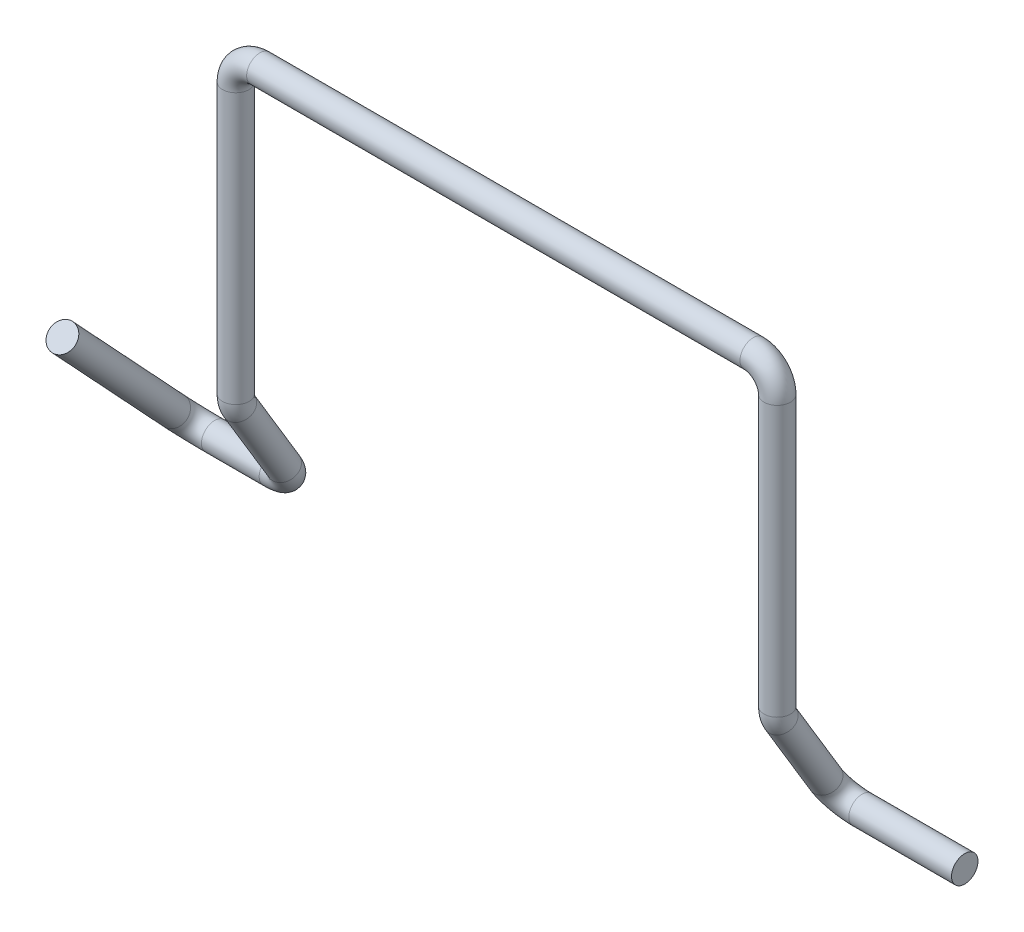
SolidWorks part; units mm, degrees
ref_plane "Front Plane" through (0, 0, 0) normal (0, 0, 1) x (1, 0, 0)
ref_plane "Top Plane" through (0, 0, 0) normal (0, 1, 0) x (1, 0, 0)
ref_plane "Right Plane" through (0, 0, 0) normal (1, 0, 0) x (0, 0, -1)
sketch "Sketch1" plane through (0, 0, 0) normal (1, 0, 0) x (0, 0, -1)
  line L0 (0, 0) -> (0, -15.875)
  line L1 (0, -15.875) -> (3.2004, -21.1963)
  circle A0 centre (0, 0) radius 0.6985 construction
  circle A1 centre (3.2004, -21.1963) radius 0.6985 construction
  dimension "D1" = 1.397
  dimension "D2" = 15.875
  dimension "D3" = 3.2004
  dimension "D4" = 5.3213
ref_plane "Plane1" through (-28.575, 0, 0) normal (1, 0, 0) x (0, 0, -1)
sketch "Sketch2" plane through (-28.575, 0, 0) normal (1, 0, 0) x (0, 0, -1)
  line L0 (0, 0) -> (0, -15.875) construction
  line L1 (0, -15.875) -> (3.2004, -21.1963) construction
  line L2 (0, 0) -> (0, -15.875)
  line L3 (0, -15.875) -> (3.2004, -21.1963)
sketch "Sketch3" plane through (0, 0, 0) normal (0, 1, 0) x (1, 0, 0)
  line L0 (0, 0) -> (-28.575, 0)
ref_plane "Plane2" through (0, -21.1963, 0) normal (0, 1, 0) x (1, 0, 0)
sketch "Sketch4" plane through (0, -21.1963, 0) normal (0, 1, 0) x (1, 0, 0)
  line L0 (0, 3.2004) -> (6.6929, 3.2004)
  line L1 (-28.575, 3.2004) -> (-34.163, 3.2004)
  dimension "D1" = 6.6929
  dimension "D2" = 5.588
ref_plane "Plane3" through (-34.163, 0, 0) normal (1, 0, 0) x (0, 0, -1)
sketch "Sketch5" plane through (-34.163, 0, 0) normal (1, 0, 0) x (0, 0, -1)
  line L0 (3.2004, -21.1963) -> (-3.5641, -13.9422)
  line L1 (3.2004, -21.1963) -> (-2.4652, -21.1963) construction
  dimension "D1" = 9.9187
  dimension "D2" = 47
sketch3d "3DSketch1"
  line L0 (-34.163, -13.9422, 3.5641) -> (-34.163, -20.2675, -2.3343)
  line L1 (-32.893, -21.1963, -3.2004) -> (-29.845, -21.1963, -3.2004)
  line L2 (-28.575, -20.108, -2.5458) -> (-28.575, -16.1771, -0.1817)
  line L3 (-28.575, -15.5225, 0) -> (-28.575, -1.27, 0)
  line L4 (-27.305, 0, 0) -> (-1.27, 0, 0)
  line L5 (0, -1.27, 0) -> (0, -15.5225, 0)
  line L6 (0, -16.1771, -0.1817) -> (0, -20.108, -2.5458)
  line L7 (1.27, -21.1963, -3.2004) -> (6.6929, -21.1963, -3.2004)
  arc A0 (-34.163, -20.2675, -2.3343) -> (-32.893, -21.1963, -3.2004) centre (-32.893, -20.2675, -2.3343) ccw
  arc A1 (-29.845, -21.1963, -3.2004) -> (-28.575, -20.108, -2.5458) centre (-29.845, -20.108, -2.5458) ccw
  arc A2 (-28.575, -16.1771, -0.1817) -> (-28.575, -15.5225, 0) centre (-28.575, -15.5225, -1.27) ccw
  arc A3 (-28.575, -1.27, 0) -> (-27.305, 0, 0) centre (-27.305, -1.27, 0) ccw
  arc A4 (-1.27, 0, 0) -> (0, -1.27, 0) centre (-1.27, -1.27, 0) ccw
  arc A5 (0, -15.5225, 0) -> (0, -16.1771, -0.1817) centre (0, -15.5225, -1.27) ccw
  arc A6 (0, -20.108, -2.5458) -> (1.27, -21.1963, -3.2004) centre (1.27, -20.108, -2.5458) ccw
  point P20 (-34.163, -21.1963, -3.2004)
  point P21 (-32.893, -21.1336, -1.4054)
  point P24 (-28.575, -21.1963, -3.2004)
  point P25 (-29.845, -20.7625, -1.4575)
  point P28 (-28.575, -15.875, 0)
  point P29 (-29.845, -15.5225, -1.27)
  point P32 (-28.575, 0, 0)
  point P33 (-27.305, -1.27, -1.27)
  point P36 (0, 0, 0)
  point P37 (-1.27, -1.27, -1.27)
  point P40 (0, -15.875, 0)
  point P41 (1.27, -15.5225, -1.27)
  point P44 (0, -21.1963, -3.2004)
  point P45 (1.27, -20.7625, -1.4575)
  dimension "D1" = 1.27
ref_plane "Plane4" through (6.6929, -21.1963, -3.2004) normal (1, 0, 0) x (0, 0, -1)
sketch "Sketch6" plane through (6.6929, -21.1963, -3.2004) normal (1, 0, 0) x (0, 0, -1)
  circle A0 centre (0, 0) radius 0.6985
  dimension "D1" = 1.397
sweep "Sweep1" add profiles "Sketch6" path "3DSketch1"
